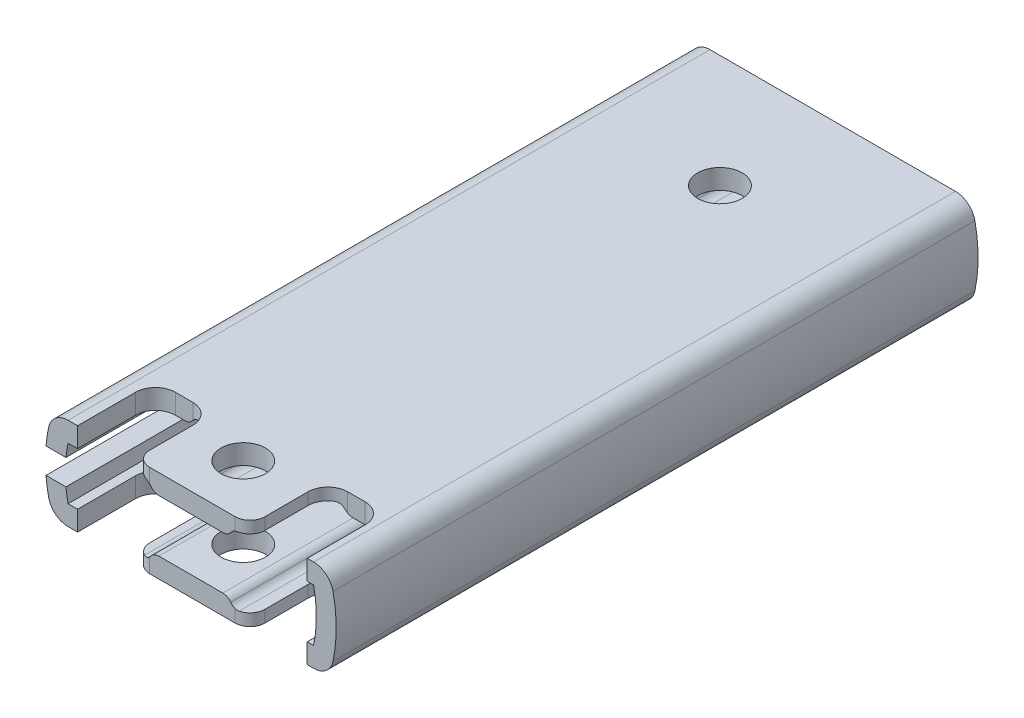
SolidWorks part; units mm, degrees
ref_plane "Front Plane" through (0, 0, 0) normal (0, 0, 1) x (1, 0, 0)
ref_plane "Top Plane" through (0, 0, 0) normal (0, 1, 0) x (1, 0, 0)
ref_plane "Right Plane" through (0, 0, 0) normal (1, 0, 0) x (0, 0, -1)
sketch "canifier" plane through (0, 0, 0) normal (0, 1, 0) x (1, 0, 0)
  line L1 (-9.779, 25.4) -> (9.779, 25.4) construction
  line L2 (-9.779, 25.4) -> (-9.779, -25.4) construction
  line L3 (-9.779, -25.4) -> (9.779, -25.4) construction
  line L4 (9.779, 25.4) -> (9.779, -25.4) construction
  line L5 (-9.779, 25.4) -> (9.779, -25.4) construction
  line L6 (-9.779, -25.4) -> (9.779, 25.4) construction
  point P0 (0, 0)
  dimension "D1" = 50.8
  dimension "D2" = 19.558
sketch "Sketch2" plane through (0, 0, 0) normal (0, 0, 1) x (1, 0, 0)
  line L0 (-9.8117, 2.0955) -> (9.8117, 2.0955)
  line L1 (0, 2.0955) -> (0, -2.0955) construction
  line L2 (-11.0214, 3.683) -> (11.0214, 3.683)
  line L3 (-9.779, 0) -> (9.779, 0) construction
  line L4 (0, 0) -> (5.4055, 0) construction
  line L5 (-9.8117, -2.0955) -> (9.8117, -2.0955)
  line L6 (-9.779, 2.2433) -> (-9.779, -2.2433) construction
  line L7 (-11.0214, -3.683) -> (11.0214, -3.683)
  circle A0 centre (0, 0) radius 13.0535 construction
  arc A1 (-9.8117, -2.0955) -> (-9.8117, 2.0955) centre (0, 0) cw
  arc A2 (9.8117, -2.0955) -> (9.8117, 2.0955) centre (0, 0) ccw
  arc A3 (11.0214, -3.683) -> (11.0214, 3.683) centre (0, 0) ccw
  arc A4 (-11.0214, -3.683) -> (-11.0214, 3.683) centre (0, 0) cw
  point P14 (-9.779, 0)
  dimension "D1" = 4.191
  dimension "D2" = 0.254
  dimension "D3" = 1.5875
extrude "Boss-Extrude1" add sketch "Sketch2" along normal mid plane 51.308
sketch "Sketch3" plane through (0, 0, -25.654) normal (0, 0, -1) x (-1, 0, 0)
  line L2 (11.0214, 3.683) -> (-11.0214, 3.683)
  line L3 (-11.0214, -3.683) -> (11.0214, -3.683)
  line L4 (11.0214, 3.683) -> (-11.0214, 3.683)
  line L5 (-11.0214, -3.683) -> (11.0214, -3.683)
  arc A2 (11.0214, -3.683) -> (11.0214, 3.683) centre (0, 0) ccw
  arc A3 (-11.0214, 3.683) -> (-11.0214, -3.683) centre (0, 0) ccw
  arc A4 (11.0214, -3.683) -> (11.0214, 3.683) centre (0, 0) ccw
  arc A5 (-11.0214, 3.683) -> (-11.0214, -3.683) centre (0, 0) ccw
  dimension "D1" = 0
extrude "Boss-Extrude2" add sketch "Sketch3" along normal blind 2.3813
sketch "Sketch4" plane through (0, 0, 25.654) normal (0, 0, 1) x (1, 0, 0)
  line L0 (9.9814, 0) -> (0, 0) construction
  line L1 (9.9814, 1.016) -> (-11.6205, 1.016)
  line L2 (9.9814, 1.016) -> (9.9814, -1.016)
  line L3 (9.9814, -1.016) -> (-11.6205, -1.016)
  line L4 (-11.6205, 1.016) -> (-11.6205, -1.016)
  line L5 (-9.779, 0) -> (9.779, 0) construction
  arc A1 (-11.0214, 3.683) -> (-11.0214, -3.683) centre (0, 0) ccw construction
  arc A2 (9.8117, -2.0955) -> (9.8117, 2.0955) centre (0, 0) ccw construction
  dimension "D1" = 2.032
extrude "Cut-Extrude1" cut sketch "Sketch4" against normal through all
sketch "Sketch7" plane through (0, -2.0955, 0) normal (0, 1, 0) x (1, 0, 0)
  line L0 (-9.8117, -25.654) -> (-9.8117, 25.654) construction
  line L1 (-9.0497, -25.654) -> (-4.4777, -25.654)
  line L2 (-9.0497, -25.654) -> (-9.0497, -19.431)
  line L3 (-9.0497, -19.431) -> (-4.4777, -19.431)
  line L4 (-4.4777, -25.654) -> (-4.4777, -19.431)
  line L5 (9.3037, -25.654) -> (4.7317, -25.654)
  line L6 (9.3037, -25.654) -> (9.3037, -19.431)
  line L7 (9.3037, -19.431) -> (4.7317, -19.431)
  line L8 (4.7317, -25.654) -> (4.7317, -19.431)
  line L10 (9.8117, -25.654) -> (9.8117, 25.654) construction
  line L11 (-9.8117, -25.654) -> (9.8117, -25.654) construction
  dimension "D1" = 4.572
  dimension "D2" = 6.223
  dimension "D3" = 0.762
  dimension "D4" = 0.508
extrude "Cut-Extrude3" cut sketch "Sketch7" against normal through all and the other way through all
sketch "Sketch8" plane through (0, 3.683, 0) normal (0, 1, 0) x (1, 0, 0)
  line L0 (0, -25.654) -> (0, -21.463) construction
  line L2 (0, 25.654) -> (0, 16.637) construction
  line L3 (-9.8117, 25.654) -> (9.8117, 25.654) construction
  line L4 (4.7317, -25.654) -> (-4.4777, -25.654) construction
  circle A0 centre (0, -21.463) radius 1.778
  circle A1 centre (0, 16.637) radius 1.778
  dimension "D2" = 3.556
  dimension "D1" = 4.191
  dimension "D3" = 9.017
extrude "Cut-Extrude4" cut sketch "Sketch8" against normal through all
sketch "Sketch9" plane through (0, 0, -28.0353) normal (0, 0, -1) x (-1, 0, 0)
  line L0 (-11.0214, -3.683) -> (11.0214, -3.683) construction
  line L1 (-12.7, 3.683) -> (12.7, 3.683)
  line L2 (-12.7, 3.683) -> (-12.7, -3.683)
  line L3 (-12.7, -3.683) -> (12.7, -3.683)
  line L4 (12.7, 3.683) -> (12.7, -3.683)
  line L5 (-12.7, 3.683) -> (12.7, -3.683) construction
  line L6 (-12.7, -3.683) -> (12.7, 3.683) construction
  point P0 (0, 0)
  dimension "D1" = 25.4
extrude "Cut-Extrude6" cut sketch "Sketch9" against normal blind 2.3813
fillet "Fillet1" radius 1.5875 8 edges at (4.7317, -2.8892, 19.431) (9.3037, 2.8892, 19.431) (9.3037, -2.8892, 19.431) (-4.4777, -2.8892, 19.431) (-9.0497, -2.8893, 19.431) (4.7317, 2.8892, 19.431) (-9.0497, 2.8892, 19.431) (-4.4777, 2.8892, 19.431)
fillet "Fillet2" radius 1.1906 4 edges at (-4.4777, -2.8892, 25.654) (4.7317, -2.8892, 25.654) (4.7317, 2.8892, 25.654) (-4.4777, 2.8892, 25.654)
fillet "Fillet3" radius 1.5875 4 edges at (-11.0214, -3.683, 0) (11.0214, -3.683, 0) (11.0214, 3.683, 0) (-11.0214, 3.683, 0)
sketch "Sketch10" plane through (0, 0, -25.654) normal (0, 0, -1) x (-1, 0, 0)
  line L0 (-9.8117, 2.0955) -> (9.8117, 2.0955) construction
  line L1 (-6.223, 2.0955) -> (-3.048, 2.0955)
  line L2 (-6.223, 2.0955) -> (-6.223, 2.7305)
  line L3 (-6.223, 2.7305) -> (-3.048, 2.7305)
  line L4 (-3.048, 2.0955) -> (-3.048, 2.7305)
  line L5 (0, 0) -> (0, 1.3494) construction
  line L6 (3.048, 2.0955) -> (3.048, 2.7305)
  line L7 (6.223, 2.7305) -> (3.048, 2.7305)
  line L8 (6.223, 2.0955) -> (6.223, 2.7305)
  line L9 (6.223, 2.0955) -> (3.048, 2.0955)
  dimension "D1" = 0.635
  dimension "D2" = 3.175
  dimension "D3" = 3.048
extrude "Cut-Extrude7" cut sketch "Sketch10" against normal through all
fillet "Fillet4" radius 0.7937 4 edges at (3.048, 2.7305, 0) (-6.223, 2.7305, -3.1115) (-3.048, 2.7305, 0) (6.223, 2.7305, -3.11)
fillet "Fillet5" radius 0.7937 4 edges at (3.048, 2.0955, 0) (6.223, 2.0955, -3.11) (-3.048, 2.0955, 0) (-6.223, 2.0955, -3.1115)
mirror "Mirror2" about plane through (0, 0, 0) normal (0, 1, 0) of "Fillet5", "Fillet4", "Cut-Extrude7"
